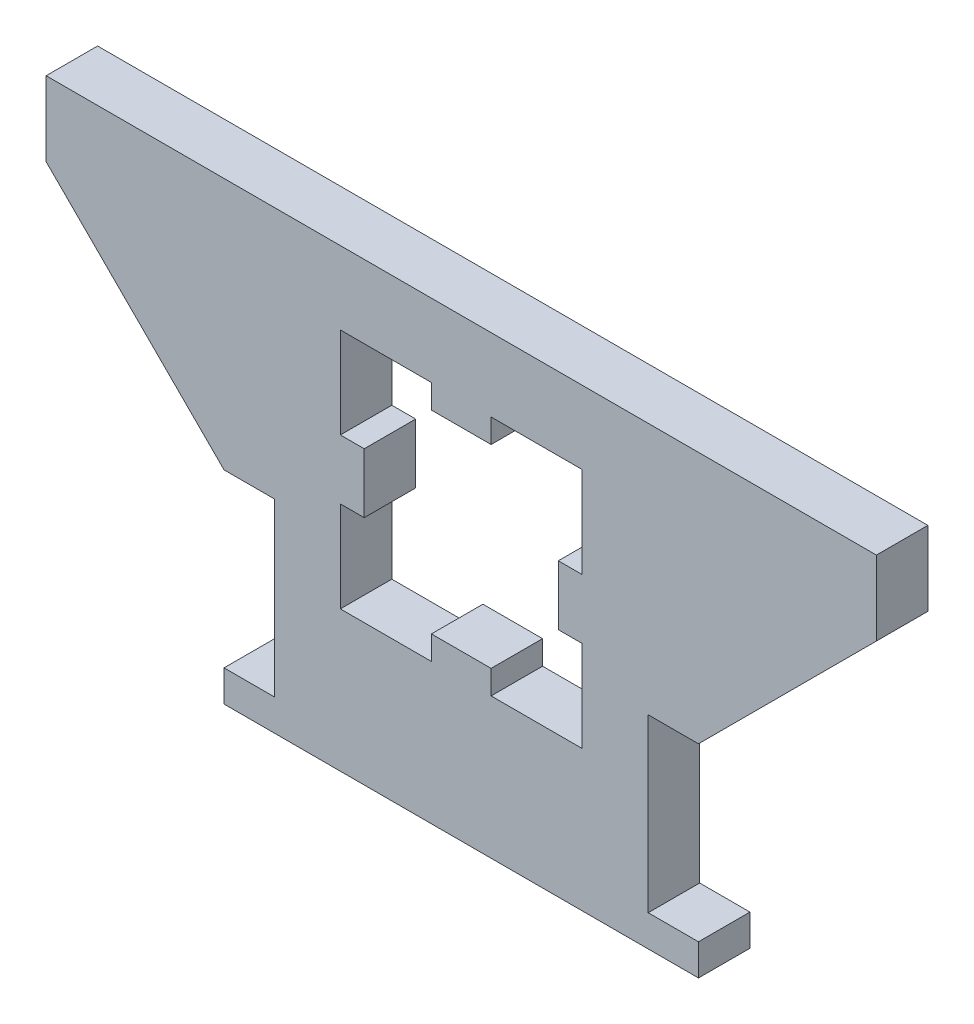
SolidWorks part; units mm, degrees
ref_plane "Front Plane" through (0, 0, 0) normal (0, 0, 1) x (1, 0, 0)
ref_plane "Top Plane" through (0, 0, 0) normal (0, 1, 0) x (1, 0, 0)
ref_plane "Right Plane" through (0, 0, 0) normal (1, 0, 0) x (0, 0, -1)
sketch "Sketch2" plane through (0, 0, 0) normal (0, 0, 1) x (1, 0, 0)
  line L0 (475.6375, 345.2127) -> (475.6375, 337.2381)
  line L1 (475.6375, 337.2381) -> (492.4046, 337.2381)
  line L2 (492.4046, 337.2381) -> (492.4046, 314.0811)
  line L3 (526.1178, 314.0811) -> (526.1178, 301.3811)
  line L4 (500.2259, 314.0811) -> (500.2259, 321.2634)
  line L5 (500.2259, 321.2634) -> (502.7819, 321.2634)
  line L6 (502.7819, 321.2634) -> (502.7819, 327.6533)
  line L7 (502.7819, 327.6533) -> (500.2259, 327.6533)
  line L8 (500.2259, 327.6533) -> (500.2259, 334.8355)
  line L9 (500.2259, 334.8355) -> (496.3919, 334.8355)
  line L10 (496.3919, 334.8355) -> (496.3919, 337.2381)
  line L11 (496.3919, 337.2381) -> (500.3792, 341.2254)
  line L12 (500.3792, 341.2254) -> (502.7819, 341.2254)
  line L13 (502.7819, 341.2254) -> (502.7819, 337.3915)
  line L14 (502.7819, 337.3915) -> (509.9769, 337.3915)
  line L15 (509.9769, 337.3915) -> (509.9769, 334.8355)
  line L16 (509.9769, 334.8355) -> (516.3668, 334.8355)
  line L17 (475.6375, 345.2127) -> (550.7061, 345.2127)
  line L18 (492.4046, 314.0811) -> (492.4046, 301.3811)
  line L19 (516.3668, 337.3915) -> (516.3668, 334.8355)
  line L20 (523.5618, 337.3915) -> (516.3668, 337.3915)
  line L21 (523.5618, 341.2254) -> (523.5618, 337.3915)
  line L22 (525.9644, 341.2254) -> (523.5618, 341.2254)
  line L23 (529.9517, 337.2381) -> (525.9644, 341.2254)
  line L24 (529.9517, 334.8355) -> (529.9517, 337.2381)
  line L25 (526.1178, 334.8355) -> (529.9517, 334.8355)
  line L26 (526.1178, 327.6533) -> (526.1178, 334.8355)
  line L27 (523.5618, 327.6533) -> (526.1178, 327.6533)
  line L28 (523.5618, 321.2634) -> (523.5618, 327.6533)
  line L29 (526.1178, 321.2634) -> (523.5618, 321.2634)
  line L30 (526.1178, 314.0811) -> (526.1178, 321.2634)
  line L31 (526.1178, 301.3811) -> (533.939, 301.3811)
  line L32 (533.939, 337.2381) -> (533.939, 314.0811)
  line L33 (550.7061, 337.2381) -> (533.939, 337.2381)
  line L34 (550.7061, 345.2127) -> (550.7061, 337.2381)
  line L35 (492.4046, 301.3811) -> (500.2259, 301.3811)
  line L36 (500.2259, 301.3811) -> (500.2259, 314.0811)
  line L37 (533.939, 301.3811) -> (533.939, 314.0811)
  point P37 (513.1718, 345.2127)
  dimension "D1" = 12.7
  dimension "D2" = 7.8212
extrude "Boss-Extrude1" add sketch "Sketch2" along normal blind 5.5118
sketch "Sketch3" plane through (0, 0, 5.5118) normal (0, 0, 1) x (1, 0, 0)
  line L0 (475.6375, 337.2381) -> (475.6375, 345.2127)
  line L1 (475.6375, 345.2127) -> (475.6375, 337.2381) construction
  line L2 (475.6375, 345.2127) -> (468.7218, 345.2127)
  line L3 (468.7218, 345.2127) -> (468.7218, 337.2381)
  line L4 (487.7718, 318.1881) -> (487.7718, 301.3811)
  line L5 (487.7718, 301.3811) -> (487.7718, 296.4709)
  line L6 (492.4046, 301.3811) -> (500.2259, 301.3811)
  line L8 (538.5718, 318.1881) -> (538.5718, 301.3811)
  line L9 (557.6218, 345.2127) -> (557.6218, 337.2381)
  line L10 (550.7061, 345.2127) -> (557.6218, 345.2127)
  line L11 (550.7061, 337.2381) -> (550.7061, 345.2127)
  line L12 (492.4046, 301.3811) -> (492.4046, 337.2381)
  line L13 (492.4046, 301.3811) -> (500.2259, 301.3811) construction
  line L14 (475.6375, 337.2381) -> (492.4046, 337.2381) construction
  line L15 (492.4046, 337.2381) -> (492.4046, 301.3811) construction
  line L16 (487.7718, 296.4709) -> (538.5718, 296.4709)
  line L17 (557.6218, 337.2381) -> (538.5718, 318.1881)
  line L18 (538.5718, 296.4709) -> (538.5718, 301.3811)
  line L19 (500.2259, 301.3811) -> (500.2259, 321.2634) construction
  line L20 (502.7819, 307.6912) -> (500.2259, 307.6912)
  line L22 (533.939, 301.3811) -> (533.939, 337.2381)
  line L23 (468.7218, 337.2381) -> (487.7718, 318.1881)
  line L25 (500.2259, 307.6912) -> (500.2259, 301.3811)
  line L28 (523.5618, 307.6912) -> (526.1178, 307.6912)
  line L29 (526.1178, 321.2634) -> (526.1178, 301.3811) construction
  line L30 (526.1178, 301.3811) -> (533.939, 301.3811)
  line L32 (500.2259, 301.3811) -> (500.2402, 301.3665)
  line L33 (526.1178, 307.6912) -> (526.1178, 301.3811)
  line L48 (509.9769, 314.0811) -> (516.3668, 314.0811)
  line L49 (509.9769, 311.5251) -> (509.9769, 314.0811)
  line L50 (502.7819, 311.5251) -> (509.9769, 311.5251)
  line L51 (502.7819, 307.6912) -> (502.7819, 311.5251)
  line L54 (516.3668, 311.5251) -> (516.3668, 314.0811)
  line L55 (523.5618, 307.6912) -> (523.5618, 311.5251)
  line L56 (523.5618, 311.5251) -> (516.3668, 311.5251)
  point P75 (513.1718, 314.0811)
  dimension "D1" = 88.9
  dimension "D2" = 21.7172
extrude "Boss-Extrude2" add sketch "Sketch3" against normal up to surface (5.5118 mm away)
sketch "Sketch4" plane through (0, 0, 5.5118) normal (0, 0, 1) x (1, 0, 0)
  line L0 (538.5718, 296.4709) -> (538.5718, 318.1881) construction
  line L1 (533.187, 318.1881) -> (538.5718, 318.1881)
  line L2 (533.187, 318.1881) -> (533.187, 299.8304)
  line L3 (533.187, 299.8304) -> (538.5718, 299.8304)
  line L4 (538.5718, 318.1881) -> (538.5718, 299.8304)
  line L7 (487.7718, 318.1881) -> (487.7718, 299.8304)
  line L8 (493.1566, 299.8304) -> (487.7718, 299.8304)
  line L9 (493.1566, 318.1881) -> (493.1566, 299.8304)
  line L10 (493.1566, 318.1881) -> (487.7718, 318.1881)
  line L25 (502.7819, 311.5251) -> (502.7819, 307.6912)
  line L26 (500.2259, 314.0811) -> (502.7819, 311.5251)
  line L27 (496.3919, 314.0811) -> (500.2259, 314.0811)
  line L28 (496.3919, 311.6785) -> (496.3919, 314.0811)
  line L29 (500.3792, 307.6912) -> (496.3919, 311.6785)
  line L30 (502.7819, 307.6912) -> (500.3792, 307.6912)
  line L31 (523.5618, 307.6912) -> (525.9644, 307.6912)
  line L32 (525.9644, 307.6912) -> (529.9517, 311.6785)
  line L33 (529.9517, 311.6785) -> (529.9517, 314.0811)
  line L34 (529.9517, 314.0811) -> (526.1178, 314.0811)
  line L35 (526.1178, 314.0811) -> (523.5618, 311.5251)
  line L36 (523.5618, 311.5251) -> (523.5618, 307.6912)
extrude "Cut-Extrude1" cut sketch "Sketch4" against normal up to surface (5.5118 mm away)
sketch "Sketch5" plane through (0, 0, 5.5118) normal (0, 0, 1) x (1, 0, 0)
  line L0 (500.2259, 314.0811) -> (500.2259, 311.5251)
  line L1 (500.2259, 311.5251) -> (502.7819, 311.5251)
  line L2 (502.7819, 307.6912) -> (502.7819, 311.5251) construction
  line L3 (502.7819, 311.5251) -> (502.7819, 307.1341)
  line L4 (502.7819, 307.1341) -> (495.4348, 307.1341)
  line L5 (495.4348, 307.1341) -> (495.4348, 314.0811)
  line L6 (495.4348, 314.0811) -> (500.2259, 314.0811)
  line L7 (500.2259, 314.0811) -> (500.1542, 314.0223)
  line L12 (526.1178, 314.0811) -> (526.1895, 314.0223)
  line L13 (530.9088, 314.0811) -> (526.1178, 314.0811)
  line L14 (530.9088, 307.1341) -> (530.9088, 314.0811)
  line L15 (523.5618, 307.1341) -> (530.9088, 307.1341)
  line L16 (523.5618, 311.5251) -> (523.5618, 307.1341)
  line L17 (526.1178, 311.5251) -> (523.5618, 311.5251)
  line L18 (526.1178, 314.0811) -> (526.1178, 311.5251)
  line L19 (526.1178, 334.8355) -> (526.1178, 337.3915)
  line L20 (526.1178, 337.3915) -> (523.5618, 337.3915)
  line L21 (523.5618, 337.3915) -> (523.5618, 341.7825)
  line L22 (523.5618, 341.7825) -> (530.9088, 341.7825)
  line L23 (530.9088, 341.7825) -> (530.9088, 334.8355)
  line L24 (530.9088, 334.8355) -> (526.1178, 334.8355)
  line L25 (526.1178, 334.8355) -> (526.1895, 334.8943)
  line L26 (500.2259, 334.8355) -> (500.1542, 334.8943)
  line L27 (495.4348, 334.8355) -> (500.2259, 334.8355)
  line L28 (495.4348, 341.7825) -> (495.4348, 334.8355)
  line L29 (502.7819, 341.7825) -> (495.4348, 341.7825)
  line L30 (502.7819, 337.3915) -> (502.7819, 341.7825)
  line L31 (500.2259, 337.3915) -> (502.7819, 337.3915)
  line L32 (500.2259, 334.8355) -> (500.2259, 337.3915)
extrude "Boss-Extrude3" add sketch "Sketch5" against normal up to surface (5.5118 mm away)
